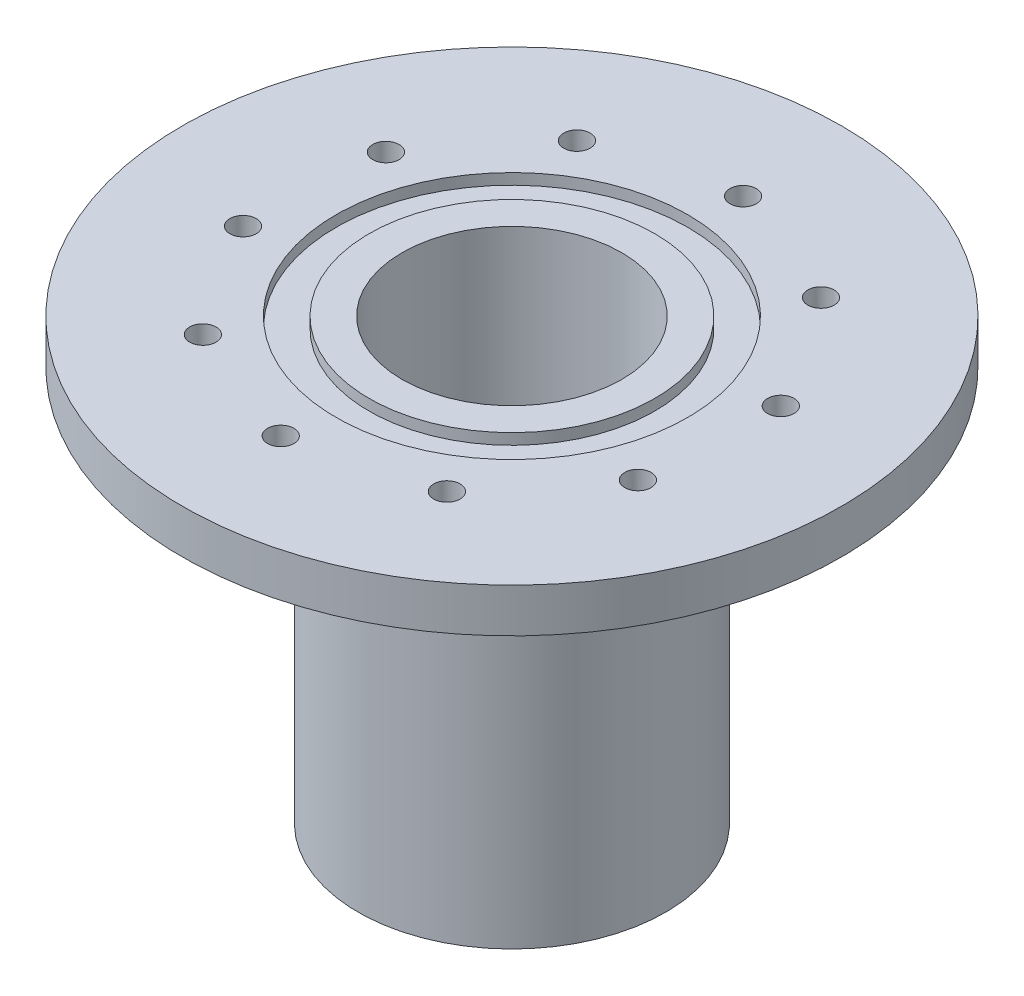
SolidWorks part; units mm, degrees
ref_plane "Front Plane" through (0, 0, 0) normal (0, 0, 1) x (1, 0, 0)
ref_plane "Top Plane" through (0, 0, 0) normal (0, 1, 0) x (1, 0, 0)
ref_plane "Right Plane" through (0, 0, 0) normal (1, 0, 0) x (0, 0, -1)
sketch "Sketch1" plane through (0, 0, 0) normal (0, 0, 1) x (1, 0, 0)
  line L0 (0, 0) -> (0, 33.9658) construction
  line L1 (0, -55) -> (0, 55) construction
  line L2 (-50, 0) -> (-50, 200)
  line L3 (55, 0) -> (-55, 0) construction
  line L5 (-150, 200) -> (-150, 180)
  line L6 (-150, 180) -> (-75, 180)
  line L7 (-70, 175) -> (-70, 0)
  line L8 (-70, 0) -> (-50, 0)
  line L9 (-80, 200) -> (-80, 195)
  line L10 (-80, 195) -> (-65, 195)
  line L11 (-65, 195) -> (-65, 200)
  line L12 (-50, 200) -> (-65, 200)
  line L13 (-80, 200) -> (-150, 200)
  arc A0 (-70, 175) -> (-75, 180) centre (-75, 175) ccw
  point P15 (-70, 180)
  dimension "D6" = 5
  dimension "D1" = 200
  dimension "D2" = 50
  dimension "D3" = 100
  dimension "D4" = 20
  dimension "D5" = 80
  dimension "D7" = 15
  dimension "D8" = 195
  dimension "D9" = 15
revolve "Revolve1" add sketch "Sketch1" angle 360 about L0
hole_wizard "Ø12.0 (12) Diameter Hole1" positions "Sketch4" profile "Sketch5" hole size "Ø12.0" standard "ANSI Metric"
sketch "Sketch4" [suppressed] plane through (-59.6282, 220, -279.3511) normal (0, 1, 0) x (1, 0, 0)
  point P0 (0, -201.3694)
  point P2 (44.8573, -189.7144)
  point P4 (98.9507, -185.6591)
  point P6 (141.3755, -212.9301)
  point P8 (166.5169, -251.0522)
  point P10 (162.7368, -318.4186)
  point P12 (128.772, -366.9991)
  point P14 (75.7424, -385.8847)
  point P16 (-17.9667, -336.5459)
  point P18 (-42.2479, -257.9026)
sketch "Sketch5" [suppressed] plane through (-59.6282, 220, -77.9817) normal (1, 0, 0) x (0, 0, 1)
  line L0 (0, 0) -> (0, 220)
  line L1 (0, 220) -> (6, 220)
  line L2 (6, 220) -> (6, 0)
  line L3 (6, 0) -> (0, 0)
  line L4 (0, -6.35) -> (0, 107.95) construction
  dimension "Thru Hole Dia." = 12
  dimension "Thru Hole Depth" = 220
hole_wizard "Ø12.0 (12) Diameter Hole2" positions "Sketch6" profile "Sketch7" hole size "Ø12.0" standard "ANSI Metric"
sketch "Sketch6" plane through (-59.6282, 240, -279.3511) normal (0, 1, 0) x (1, 0, 0)
  point P0 (64.9933, -179.4952)
  point P3 (122.6625, -201.7195)
  point P6 (156.2548, -253.5965)
  point P9 (152.939, -315.3109)
  point P12 (113.9816, -363.2899)
  point P15 (54.2631, -379.2071)
  point P18 (-3.4062, -356.9828)
  point P21 (-36.9984, -305.1058)
  point P24 (-33.6826, -243.3914)
  point P27 (5.2748, -195.4124)
sketch "Sketch7" plane through (5.3651, 240, -99.856) normal (1, 0, 0) x (0, 0, 1)
  line L0 (0, 0) -> (0, 240)
  line L1 (0, 240) -> (6, 240)
  line L2 (6, 240) -> (6, 0)
  line L3 (6, 0) -> (0, 0)
  line L4 (0, -6.35) -> (0, 107.95) construction
  dimension "Thru Hole Dia." = 12
  dimension "Thru Hole Depth" = 240
